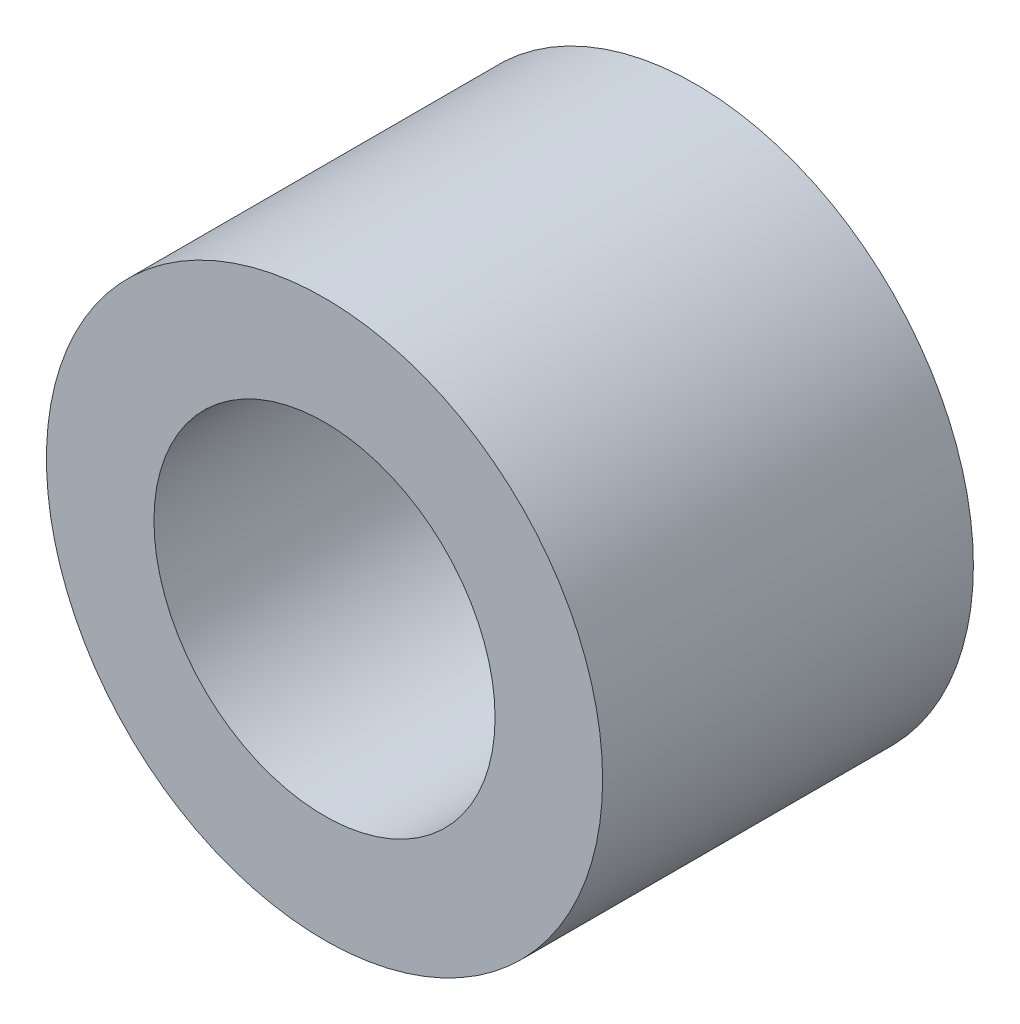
SolidWorks part; units mm, degrees
ref_plane "Front Plane" through (0, 0, 0) normal (0, 0, 1) x (1, 0, 0)
ref_plane "Top Plane" through (0, 0, 0) normal (0, 1, 0) x (1, 0, 0)
ref_plane "Right Plane" through (0, 0, 0) normal (1, 0, 0) x (0, 0, -1)
sketch "Sketch1" plane through (0, 0, 0) normal (0, 0, 1) x (1, 0, 0)
  line L0 (0, 1.4605) -> (0, 2.3813) construction
  line L1 (0, -1.4605) -> (0, -2.3813) construction
  circle A0 centre (0, 0) radius 2.3813
  circle A1 centre (0, 0) radius 1.4605
  dimension "OD" = 4.7625
  dimension "ID" = 2.921
sketch "Sketch2" plane through (0, 0, 0) normal (1, 0, 0) x (0, 0, -1)
  line L0 (-1.5875, 1.4605) -> (1.5875, 1.4605) construction
  line L1 (-1.5875, -1.4605) -> (1.5875, -1.4605) construction
  line L2 (-1.5875, -2.3813) -> (1.5875, -2.3813) construction
  line L3 (-1.5875, 2.3813) -> (1.5875, 2.3813) construction
  dimension "Length" = 3.175
extrude "Extrude1" add sketch "Sketch1" along normal up to vertex (1.5875 mm away) and the other way up to vertex (1.5875 mm away)
sketch "Sketch3" plane through (0, 0, 1.5875) normal (0, 0, 1) x (1, 0, 0)
  circle A0 centre (0, 0) radius 1.4605 construction
  circle A3 centre (0, 0) radius 1.4605
  point P3 (-1.4605, 0)
